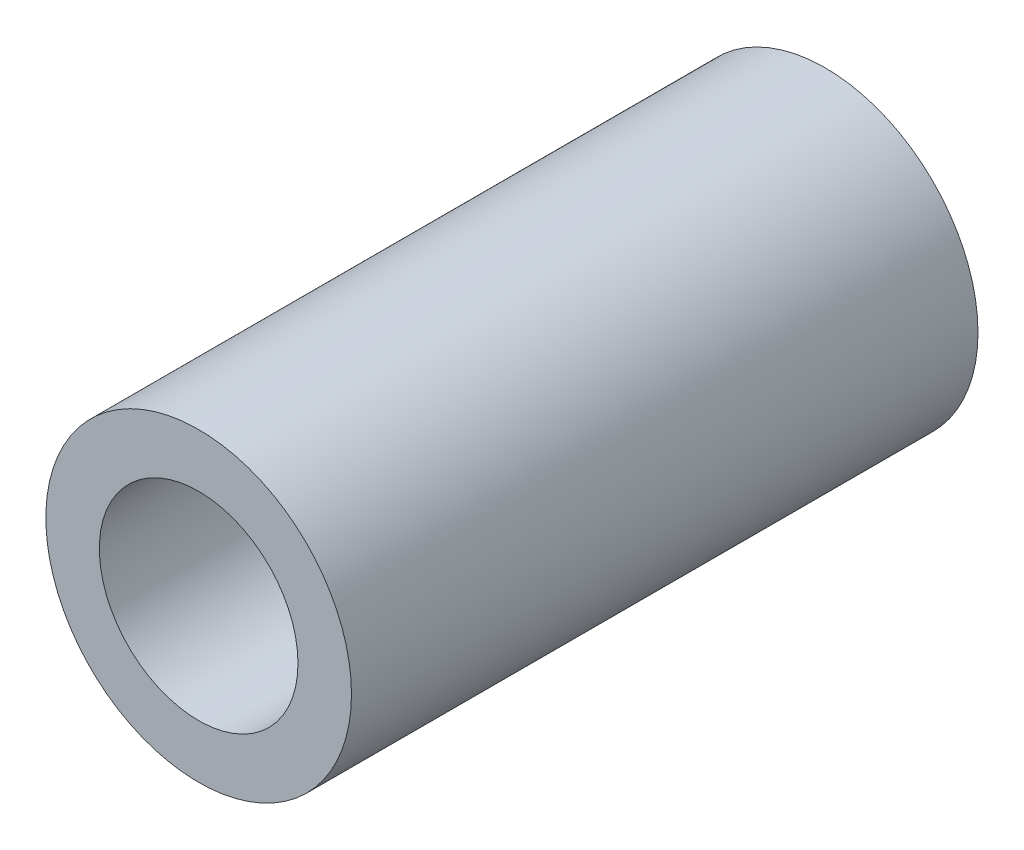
SolidWorks part; units mm, degrees
ref_plane "Спереди" through (0, 0, 0) normal (0, 0, 1) x (1, 0, 0)
ref_plane "Сверху" through (0, 0, 0) normal (0, 1, 0) x (1, 0, 0)
ref_plane "Справа" through (0, 0, 0) normal (1, 0, 0) x (0, 0, -1)
sketch "Эскиз1" plane through (0, 0, 0) normal (0, 0, 1) x (1, 0, 0)
  circle A0 centre (0, 0) radius 3.25
  circle A1 centre (0, 0) radius 5
  dimension "D1" = 6.5
  dimension "D2" = 10
extrude "Бобышка-Вытянуть1" add sketch "Эскиз1" along normal blind 20.5
